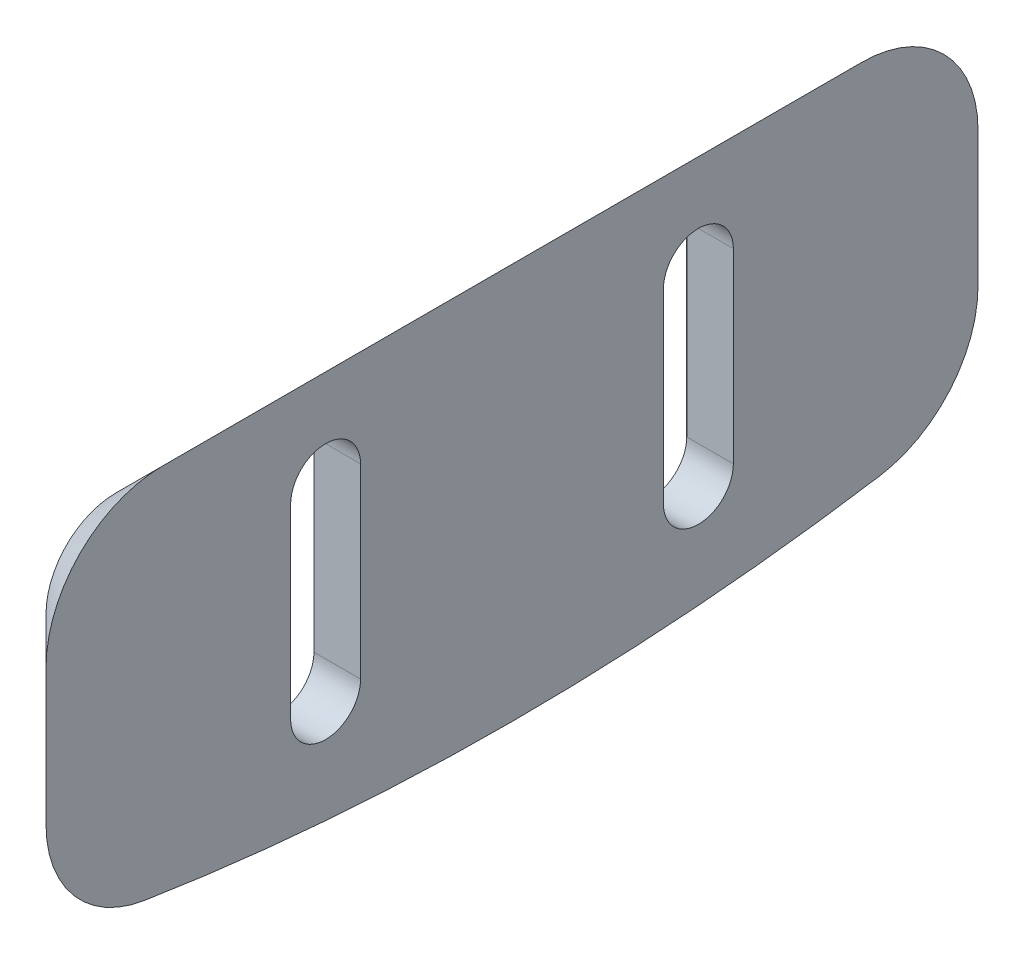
SolidWorks part; units mm, degrees
ref_plane "前视基准面" through (0, 0, 0) normal (0, 0, 1) x (1, 0, 0)
ref_plane "上视基准面" through (0, 0, 0) normal (0, 1, 0) x (1, 0, 0)
ref_plane "右视基准面" through (0, 0, 0) normal (1, 0, 0) x (0, 0, -1)
sketch "草图1" plane through (0, 0, 0) normal (1, 0, 0) x (0, 0, -1)
  line L0 (0, 0) -> (0, 35.1042) construction
  line L3 (-20, 2) -> (-20, 17)
  line L4 (-20, 17) -> (20, 17)
  line L5 (20, 2) -> (20, 17)
  arc A0 (-20, 2) -> (20, 2) centre (0, 101) ccw
  point P3 (0, 13.8056)
  point P9 (0, 17)
  dimension "D1" = 17
  dimension "D2" = 40
  dimension "D3" = 15
extrude "凸台-拉伸1" add sketch "草图1" along normal blind 2
sketch "草图2" plane through (2, 0, 0) normal (1, 0, 0) x (0, 0, -1)
  line L0 (0, 0) -> (0, 24.7361) construction
  line L1 (-8, 4.8322) -> (-8, 12.8322) construction
  line L2 (-9.5, 4.8322) -> (-9.5, 12.8322)
  line L3 (-6.5, 4.8322) -> (-6.5, 12.8322)
  line L4 (8, 4.8322) -> (8, 12.8322) construction
  line L5 (9.5, 4.8322) -> (9.5, 12.8322)
  line L6 (6.5, 4.8322) -> (6.5, 12.8322)
  arc A0 (-9.5, 4.8322) -> (-6.5, 4.8322) centre (-8, 4.8322) ccw
  arc A1 (-6.5, 12.8322) -> (-9.5, 12.8322) centre (-8, 12.8322) ccw
  arc A3 (-20, 2) -> (20, 2) centre (0, 101) ccw construction
  arc A4 (9.5, 4.8322) -> (6.5, 4.8322) centre (8, 4.8322) cw
  arc A5 (6.5, 12.8322) -> (9.5, 12.8322) centre (8, 12.8322) cw
  point P5 (-8, 8.8322)
  point P15 (8, 8.8322)
  dimension "D3" = 3
  dimension "D1" = 3
  dimension "D2" = 8
  dimension "D4" = 8
extrude "切除-拉伸1" cut sketch "草图2" against normal blind 2
fillet "圆角1" radius 5 4 edges at (1, 2, 20) (1, 2, -20) (1, 17, -20) (1, 17, 20)
chamfer "倒角1" distance 2 angle 45 8 edges at (0, 0, 0) (0, 2.9315, -18.8017) (0, 2.9315, 18.8017) (0, 9.0896, -20) (0, 9.0896, 20) (0, 15.5355, -18.5355) (0, 15.5355, 18.5355) (0, 17, 0)
